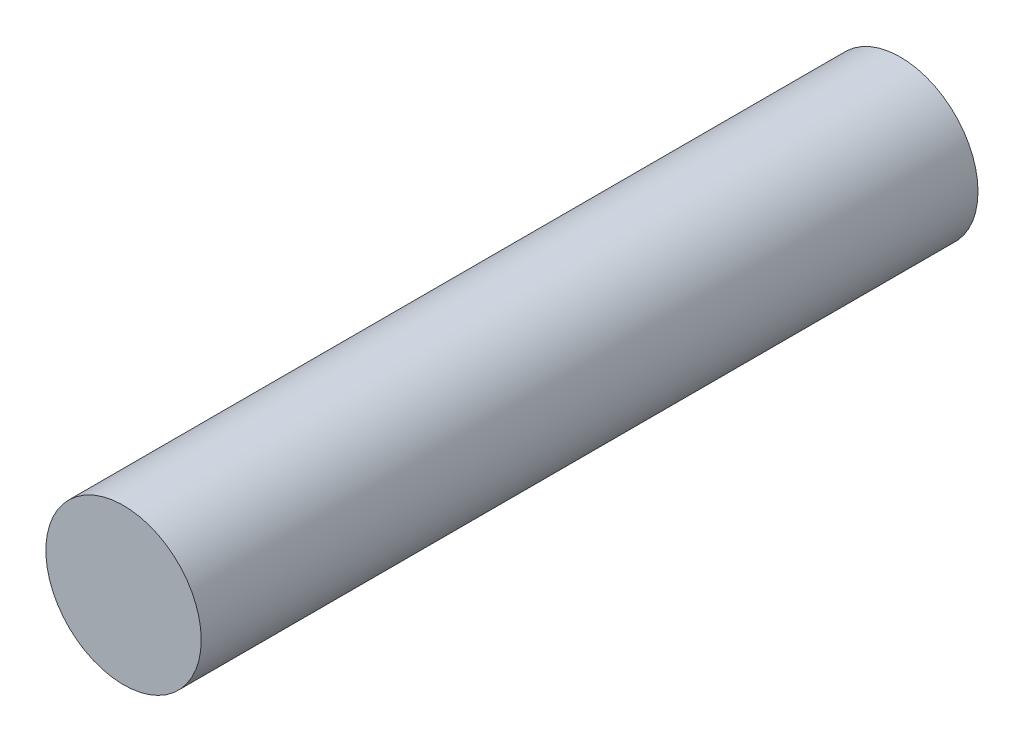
SolidWorks part; units mm, degrees
ref_plane "Ebene vorne" through (0, 0, 0) normal (0, 0, 1) x (1, 0, 0)
ref_plane "Ebene oben" through (0, 0, 0) normal (0, 1, 0) x (1, 0, 0)
ref_plane "Ebene rechts" through (0, 0, 0) normal (1, 0, 0) x (0, 0, -1)
sketch "Skizze1" plane through (0, 0, 0) normal (1, 0, 0) x (0, 0, -1)
  line L0 (0, 0) -> (83.8352, 0) construction
  line L2 (0, 0) -> (20, 0)
  line L3 (0, 0) -> (0, 2)
  line L4 (0, 2) -> (20, 2)
  line L5 (20, 0) -> (20, 2)
  point P6 (10, 0)
  dimension "D1" = 2
  dimension "D2" = 20
  dimension "D3" = 10
revolve "Rotation1" add sketch "Skizze1" angle 360 about L0
